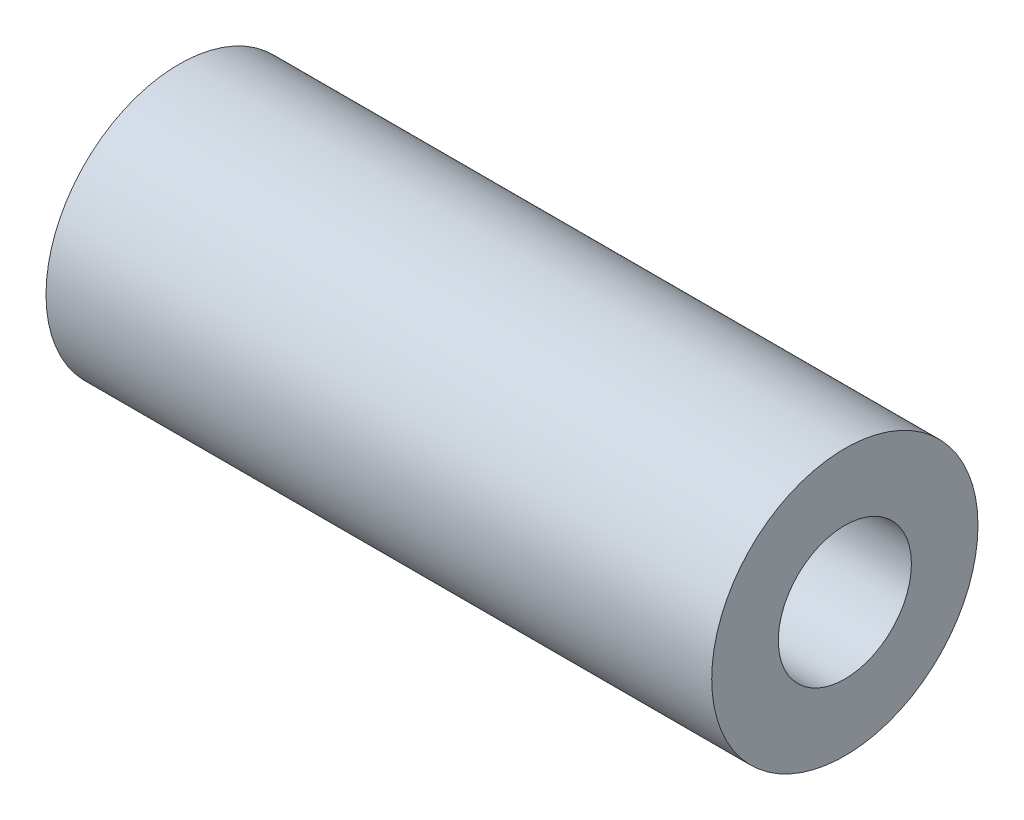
SolidWorks part; units mm, degrees
ref_plane "Plan1" through (0, 0, 0) normal (0, 0, 1) x (1, 0, 0)
ref_plane "Plan2" through (0, 0, 0) normal (0, 1, 0) x (1, 0, 0)
ref_plane "Plan3" through (0, 0, 0) normal (1, 0, 0) x (0, 0, -1)
sketch "Esquisse1" plane through (0, 0, 0) normal (1, 0, 0) x (0, 0, -1)
  circle A0 centre (0, 0) radius 5
  circle A1 centre (0, 0) radius 2.5
  dimension "D1" = 10
  dimension "D2" = 5
extrude "Base-Extrusion" add sketch "Esquisse1" along normal blind 25
